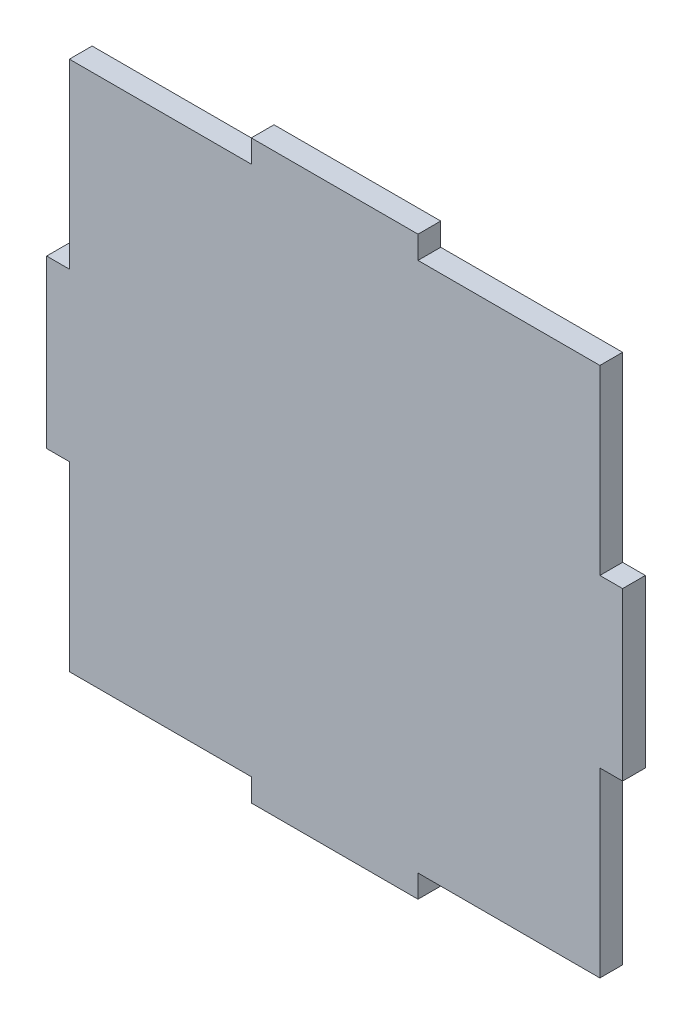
SolidWorks part; units mm, degrees
ref_plane "Front Plane" through (0, 0, 0) normal (0, 0, 1) x (1, 0, 0)
ref_plane "Top Plane" through (0, 0, 0) normal (0, 1, 0) x (1, 0, 0)
ref_plane "Right Plane" through (0, 0, 0) normal (1, 0, 0) x (0, 0, -1)
sketch "Sketch1" plane through (0, 0, 0) normal (0, 0, 1) x (1, 0, 0)
  line L0 (-24, 70) -> (0, 70)
  line L1 (-70, 70) -> (-46, 70)
  line L2 (-70, 70) -> (-70, 46)
  line L3 (-70, 0) -> (-46, 0)
  line L4 (0, 70) -> (0, 46)
  line L6 (-46, 70) -> (-46, 73)
  line L7 (-46, 73) -> (-24, 73)
  line L8 (-24, 70) -> (-24, 73)
  line L9 (-24, 0) -> (0, 0)
  line L10 (-24, 0) -> (-24, -3)
  line L11 (-46, 0) -> (-46, -3)
  line L13 (-46, -3) -> (-24, -3)
  line L15 (-70, 24) -> (-70, 0)
  line L16 (-70, 46) -> (-73, 46)
  line L18 (-70, 24) -> (-73, 24)
  line L19 (-73, 46) -> (-73, 24)
  line L20 (0, 24) -> (3, 24)
  line L21 (0, 46) -> (3, 46)
  line L22 (3, 46) -> (3, 24)
  line L23 (0, 24) -> (0, 0)
  dimension "D1" = 70
  dimension "D2" = 70
  dimension "D3" = 3
  dimension "D4" = 22
  dimension "D5" = 3
extrude "Boss-Extrude1" add sketch "Sketch1" along normal blind 3
